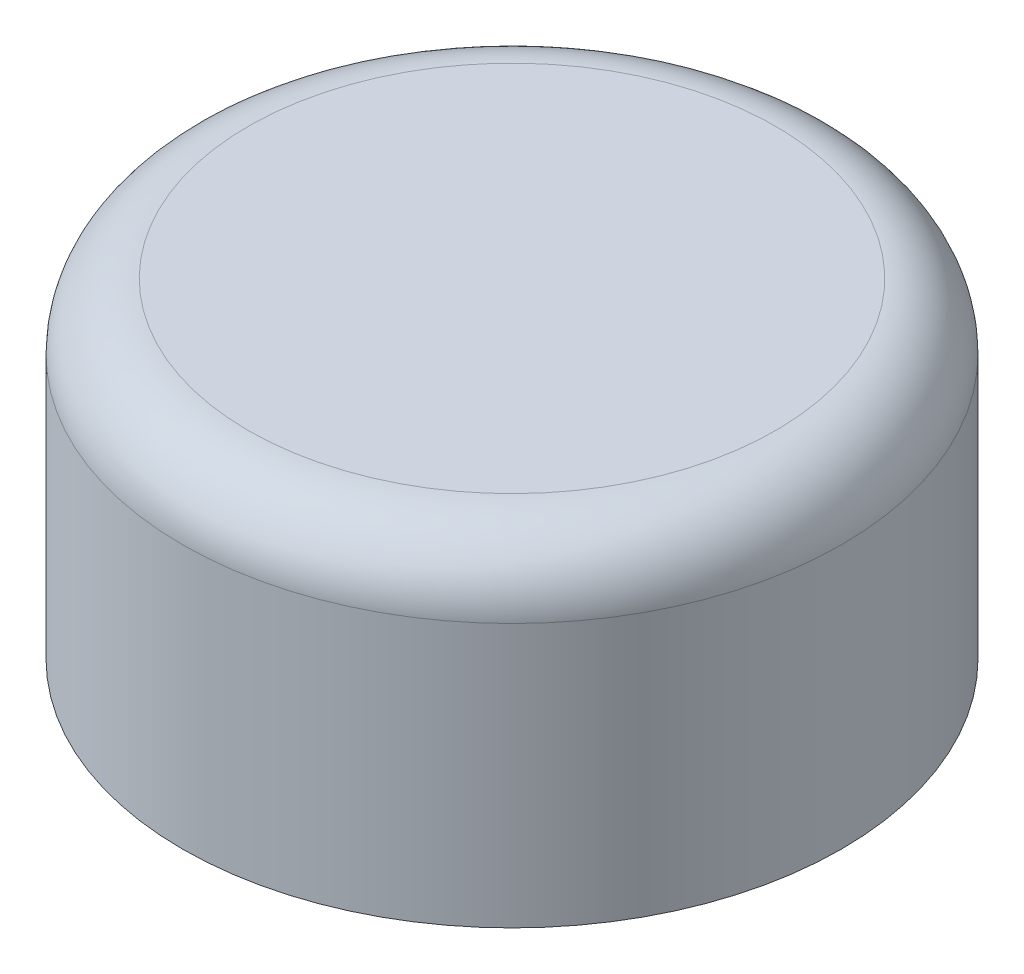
SolidWorks part; units mm, degrees
ref_plane "Front Plane" through (0, 0, 0) normal (0, 0, 1) x (1, 0, 0)
ref_plane "Top Plane" through (0, 0, 0) normal (0, 1, 0) x (1, 0, 0)
ref_plane "Right Plane" through (0, 0, 0) normal (1, 0, 0) x (0, 0, -1)
sketch "Sketch1" plane through (0, 0, 0) normal (0, 1, 0) x (1, 0, 0)
  circle A0 centre (0, 0) radius 10
extrude "Boss-Extrude1" add sketch "Sketch1" along normal blind 10
fillet "Fillet1" radius 2 1 edges at (0, 10, 10)
sketch "Sketch2" plane through (0, 0, 0) normal (0, -1, 0) x (1, 0, 0)
  circle A0 centre (0, 0) radius 4
extrude "Cut-Extrude1" cut sketch "Sketch2" against normal blind 5 contours A0
